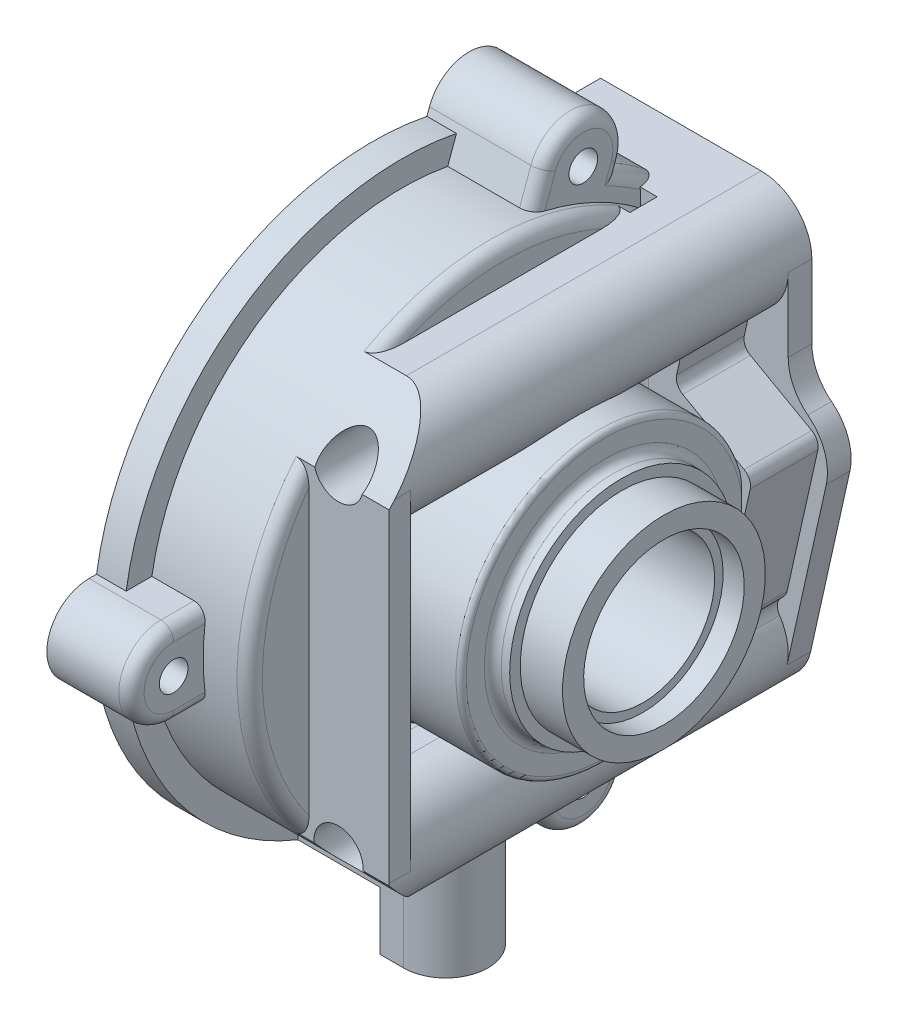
SolidWorks part; units mm, degrees
ref_plane "Face" through (0, 0, 0) normal (0, 0, 1) x (1, 0, 0)
ref_plane "Dessus" through (0, 0, 0) normal (0, 1, 0) x (1, 0, 0)
ref_plane "Droite" through (0, 0, 0) normal (1, 0, 0) x (0, 0, -1)
mirrored part "demi-carter droit-"
